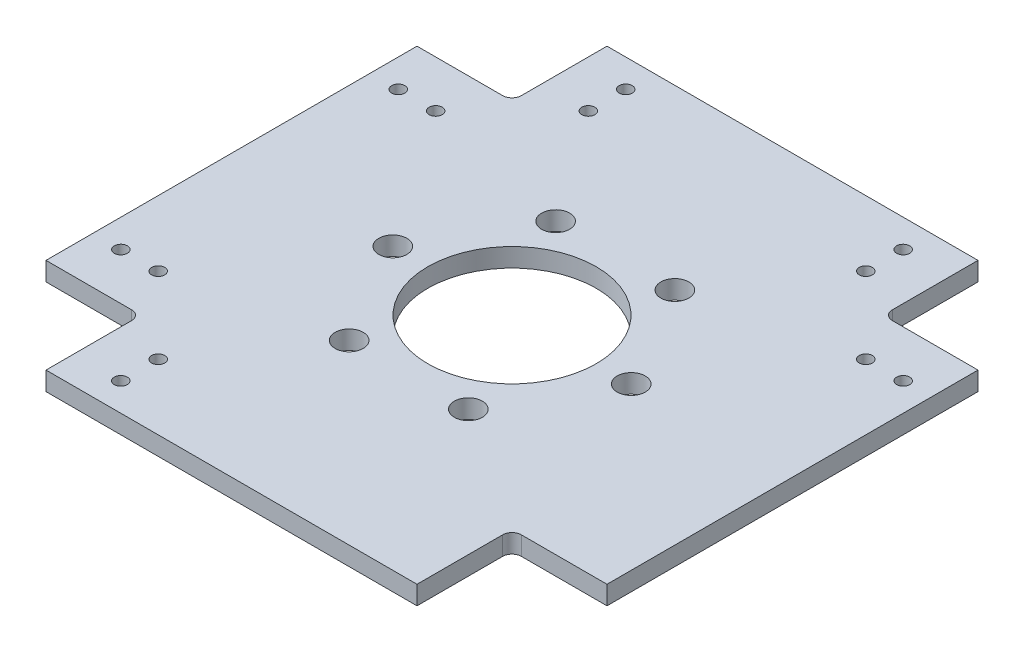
SolidWorks part; units mm, degrees
ref_plane "Front Plane" through (0, 0, 0) normal (0, 0, 1) x (1, 0, 0)
ref_plane "Top Plane" through (0, 0, 0) normal (0, 1, 0) x (1, 0, 0)
ref_plane "Right Plane" through (0, 0, 0) normal (1, 0, 0) x (0, 0, -1)
sketch "Sketch1" plane through (0, 0, 0) normal (0, 1, 0) x (1, 0, 0)
  line L0 (-99.2, 150) -> (-99.2, 99.2)
  line L1 (-99.2, -150) -> (99.2, -150)
  line L2 (-150, -99.2) -> (-150, 99.2)
  line L3 (-99.2, 150) -> (99.2, 150)
  line L4 (150, -99.2) -> (150, 99.2)
  line L5 (-124.6, -124.6) -> (99.2, 99.2) construction
  line L6 (-99.2, 99.2) -> (99.2, -99.2) construction
  line L7 (-150, -150) -> (-99.2, -150) construction
  line L8 (-150, -150) -> (-150, -99.2) construction
  line L9 (-150, -99.2) -> (-99.2, -99.2)
  line L10 (-99.2, -150) -> (-99.2, -99.2)
  line L11 (-124.6, -124.6) -> (-99.2, -99.2) construction
  line L12 (-150, -99.2) -> (-99.2, -150) construction
  line L13 (-150, 99.2) -> (-99.2, 99.2)
  line L14 (150, 99.2) -> (99.2, 99.2)
  line L15 (99.2, 150) -> (99.2, 99.2)
  line L16 (99.2, -150) -> (99.2, -99.2)
  line L17 (150, -99.2) -> (99.2, -99.2)
  line L18 (-150, -150) -> (-99.2, -150) construction
  line L19 (-150, -150) -> (-124.6, -124.6) construction
  line L20 (-150, -150) -> (-124.6, -124.6) construction
  line L21 (-150, -150) -> (-150, -99.2) construction
  line L22 (99.2, -150) -> (150, -150) construction
  line L23 (99.2, -99.2) -> (150, -150) construction
  line L24 (150, -150) -> (150, -99.2) construction
  line L25 (150, 99.2) -> (150, 150) construction
  line L26 (99.2, 99.2) -> (150, 150) construction
  line L27 (99.2, 150) -> (150, 150) construction
  line L28 (-150, 150) -> (-99.2, 150) construction
  line L29 (-150, 150) -> (-99.2, 99.2) construction
  line L30 (-150, 99.2) -> (-150, 150) construction
  line L31 (150, -99.2) -> (150, 99.2) construction
  circle A0 centre (0, 0) radius 45
  point P10 (-124.6, -124.6)
  point P23 (0, 0)
  dimension "D1" = 90
  dimension "D2" = 4
  dimension "2 in sqaure tubeing" = 50.8
extrude "Boss-Extrude1" add sketch "Sketch1" along normal blind 10
fillet "Fillet1" radius 5 4 edges at (-99.2, 5, 99.2) (99.2, 5, 99.2) (99.2, 5, -99.2) (-99.2, 5, -99.2)
sketch "Sketch2" plane through (0, 0, 0) normal (0, -1, 0) x (1, 0, 0)
  circle A0 centre (40.1279, -80) radius 6.35 construction
  circle A1 centre (-40.1279, -80) radius 6.35 construction
  circle A2 centre (40.1279, 80) radius 6.35 construction
  circle A3 centre (-40.1279, 80) radius 6.35 construction
  circle A4 centre (40.1279, -80) radius 6.35
  circle A5 centre (-40.1279, -80) radius 6.35
  circle A6 centre (40.1279, 80) radius 6.35
  circle A7 centre (-40.1279, 80) radius 6.35
extrude "Cut-Extrude1" cut sketch "Sketch2" against normal blind 5
chamfer "Chamfer1" distance 1 angle 45 4 edges at (-40.1279, 0, 73.65) (40.1279, 0, 73.65) (-40.1279, 0, -86.35) (40.1279, 0, -86.35)
sketch "Sketch3" plane through (0, 10, 0) normal (0, 1, 0) x (1, 0, 0)
  line L0 (0, 0) -> (147.2102, -147.2102)
  circle A0 centre (135, -74.2) radius 3.5 construction
  circle A1 centre (115, -74.2) radius 3.5 construction
  circle A2 centre (135, -74.2) radius 3.5
  circle A3 centre (115, -74.2) radius 3.5
  arc A4 (140.475, -150) -> (150, -140.475) centre (140.475, -140.475) ccw construction
  circle A5 centre (74.2, -135) radius 3.5
  circle A6 centre (74.2, -115) radius 3.5
  circle A7 centre (-74.2, -115) radius 3.5
  circle A8 centre (-74.2, -135) radius 3.5
  circle A9 centre (-135, -74.2) radius 3.5
  circle A10 centre (-115, -74.2) radius 3.5
  circle A11 centre (-115, 74.2) radius 3.5
  circle A12 centre (-135, 74.2) radius 3.5
  circle A13 centre (-74.2, 135) radius 3.5
  circle A14 centre (-74.2, 115) radius 3.5
  circle A15 centre (74.2, 115) radius 3.5
  circle A16 centre (74.2, 135) radius 3.5
  circle A17 centre (135, 74.2) radius 3.5
  circle A18 centre (115, 74.2) radius 3.5
  point P43 (0, 0)
  dimension "D1" = 4
extrude "Cut-Extrude2" cut sketch "Sketch3" against normal through all contours A12 | A11 | A13 | A14 | A15 | A16 | A18 | A17 | A8 | A7 | A9 | A10
sketch "Sketch4" plane through (0, 0, 0) normal (0, -1, 0) x (1, 0, 0)
  line L12 (-99.2, 150) -> (-99.2, 104.2)
  line L13 (-104.2, 99.2) -> (-150, 99.2)
  line L14 (-150, 99.2) -> (-150, -99.2)
  line L15 (-150, -99.2) -> (-104.2, -99.2)
  line L16 (-99.2, -104.2) -> (-99.2, -150)
  line L17 (-99.2, -150) -> (99.2, -150)
  line L18 (99.2, -150) -> (99.2, -104.2)
  line L19 (104.2, -99.2) -> (150, -99.2)
  line L20 (150, -99.2) -> (150, 99.2)
  line L21 (150, 99.2) -> (104.2, 99.2)
  line L22 (99.2, 104.2) -> (99.2, 150)
  line L23 (99.2, 150) -> (-99.2, 150)
  line L24 (-99.2, 150) -> (-99.2, 104.2)
  line L25 (-104.2, 99.2) -> (-150, 99.2)
  line L26 (-150, 99.2) -> (-150, -99.2)
  line L27 (-150, -99.2) -> (-104.2, -99.2)
  line L28 (-99.2, -104.2) -> (-99.2, -150)
  line L29 (-99.2, -150) -> (99.2, -150)
  line L30 (99.2, -150) -> (99.2, -104.2)
  line L31 (104.2, -99.2) -> (150, -99.2)
  line L32 (150, -99.2) -> (150, 99.2)
  line L33 (150, 99.2) -> (104.2, 99.2)
  line L34 (99.2, 104.2) -> (99.2, 150)
  line L35 (99.2, 150) -> (-99.2, 150)
  circle A0 centre (-63.75, 0) radius 7.5 construction
  circle A1 centre (-63.75, 0) radius 7.5
  circle A2 centre (-31.875, -55.2091) radius 7.5 construction
  circle A3 centre (31.875, -55.2091) radius 7.5 construction
  arc A4 (-104.2, 99.2) -> (-99.2, 104.2) centre (-104.2, 104.2) ccw
  arc A5 (-99.2, -104.2) -> (-104.2, -99.2) centre (-104.2, -104.2) ccw
  arc A6 (104.2, -99.2) -> (99.2, -104.2) centre (104.2, -104.2) ccw
  arc A7 (99.2, 104.2) -> (104.2, 99.2) centre (104.2, 104.2) ccw
  arc A8 (-104.2, 99.2) -> (-99.2, 104.2) centre (-104.2, 104.2) ccw
  arc A9 (-99.2, -104.2) -> (-104.2, -99.2) centre (-104.2, -104.2) ccw
  arc A10 (104.2, -99.2) -> (99.2, -104.2) centre (104.2, -104.2) ccw
  arc A11 (99.2, 104.2) -> (104.2, 99.2) centre (104.2, 104.2) ccw
  circle A12 centre (63.75, 0) radius 7.5 construction
  circle A13 centre (31.875, 55.2091) radius 7.5 construction
  circle A14 centre (-31.875, 55.2091) radius 7.5 construction
  circle A15 centre (-31.875, -55.2091) radius 7.5
  circle A16 centre (31.875, -55.2091) radius 7.5
  circle A17 centre (63.75, 0) radius 7.5
  circle A18 centre (31.875, 55.2091) radius 7.5
  circle A19 centre (-31.875, 55.2091) radius 7.5
  dimension "D1" = 0
extrude "Cut-Extrude3" cut sketch "Sketch4" against normal through all contours A15 | A16 | A17 | A18 | A19 | A1
